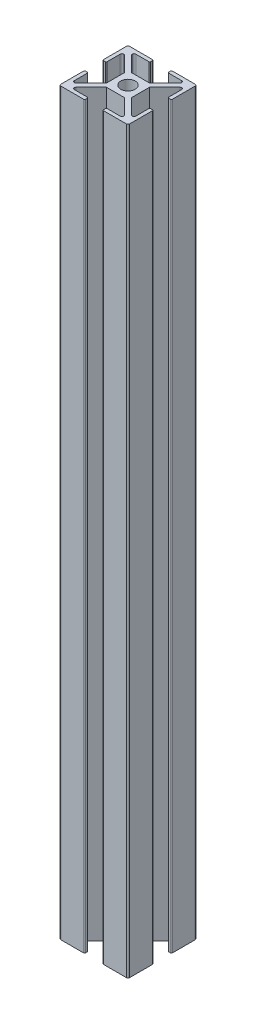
SolidWorks part; units mm, degrees
ref_plane "Front Plane" through (0, 0, 0) normal (0, 0, 1) x (1, 0, 0)
ref_plane "Top Plane" through (0, 0, 0) normal (0, 1, 0) x (1, 0, 0)
ref_plane "Right Plane" through (0, 0, 0) normal (1, 0, 0) x (0, 0, -1)
sketch "Sketch2" plane through (0, 0, 0) normal (0, 1, 0) x (1, 0, 0)
  line L12 (-10, -8.9393) -> (8.9393, 10)
  line L13 (-3.66, -3.66) -> (3.66, -3.66)
  line L26 (-3.66, -3.66) -> (-3.66, 3.66)
  line L27 (-3.66, 3.66) -> (3.66, 3.66)
  line L32 (3.66, -3.66) -> (3.66, 3.66)
  line L37 (-3.66, -3.66) -> (3.66, 3.66) construction
  line L50 (-3.66, 3.66) -> (3.66, -3.66) construction
  line L51 (-10, -8.9393) -> (-8.9393, -10)
  line L52 (8.9393, 10) -> (10, 8.9393)
  line L53 (-8.9393, -10) -> (10, 8.9393)
  line L54 (-10, -8.9393) -> (10, 8.9393) construction
  line L55 (8.9393, 10) -> (-8.9393, -10) construction
  line L56 (0, 0) -> (0, 25.4805) construction
  line L57 (10, 8.9393) -> (2.63, 8.9393)
  line L58 (-10, -8.9393) -> (-10, -10)
  line L59 (-10, -10) -> (-8.9393, -10)
  line L60 (10, 8.9393) -> (10, 10)
  line L61 (10, 10) -> (2.63, 10)
  line L62 (2.63, 8.9393) -> (2.63, 10)
  line L63 (5.995, 7.0557) -> (5.995, 8.9393)
  line L64 (10, 10) -> (10, 2.63)
  line L65 (8.9393, 10) -> (10, 10)
  line L66 (8.9393, 2.63) -> (10, 2.63)
  line L67 (8.9393, 10) -> (8.9393, 2.63)
  circle A0 centre (0, 0) radius 2.095
  point P0 (0, 0)
  dimension "D3" = 4.19
  dimension "D1" = 7.32
  dimension "D2" = 7.32
  dimension "D4" = 20
  dimension "D5" = 1.5
  dimension "D6" = 2.63
  dimension "D8" = 5.995
  dimension "D7" = 90
extrude "Boss-Extrude1" add sketch "Sketch2" along normal blind 215 contours L53 L67 L66 L64 | L67 L57 L12 L27 L32 L53 | L67 L12 L57 | L52 L67 L57 | L60 L61 L52 | L57 L67 L53 | L62 L57 L12 L61 | A0 L53 L32 L27 L12 | A0 L53 L13 L32 | A0 L12 L27 L26 | A0 L12 L26 L13 L53
fillet "Fillet1" radius 0.5 3 edges at (7.8787, 107.5, -8.9393) (8.9393, 107.5, -7.8787) (10, 107.5, -10)
fillet "Fillet2" radius 0.25 4 edges at (2.63, 107.5, -10) (2.63, 107.5, -8.9393) (8.9393, 107.5, -2.63) (10, 107.5, -2.63)
pattern_circular "CirPattern1" count 4 over 360 about axis through (0, 0, 0) along (0, 1, 0) of "Boss-Extrude1", "Fillet2", "Fillet1"
sketch "Sketch3" plane through (-10, 0, 0) normal (-1, 0, 0) x (0, 0, 1)
  line L0 (2.5993, 0) -> (-2.5993, 0) construction
  line L1 (10, 215) -> (10, 0) construction
  line L4 (-9.5, 215) -> (-2.88, 215) construction
  circle A0 centre (0, 25) radius 2.095
  circle A1 centre (0, 190) radius 2.095
  point P12 (0, 0)
  dimension "D1" = 4.19
  dimension "D2" = 25
  dimension "D3" = 10
  dimension "D4" = 25
  dimension "D5" = 10
  dimension "D6" = 4.19
extrude "Cut-Extrude2" cut sketch "Sketch3" against normal blind 60
thread "Thread1" pitch 0.7 start angle 0, offset 0, length 10, pitch 0.7, diameter 4.19
ref_plane "Plane1" through (-3.66, 190, -2.095) normal (0, -1, 0) x (0, 0, -1)
sketch "Thread Profile1" plane through (-3.66, 190, -2.095) normal (0, -1, 0) x (0, 0, -1)
  line L0 (0, 0) -> (0, 0.7) construction
  line L1 (0, 0) -> (0.3789, 0.2187)
  line L2 (0.3789, 0.2187) -> (0.3789, 0.3062)
  line L3 (0.3789, 0.3062) -> (0, 0.525)
  line L4 (0.3789, 0.2625) -> (0, 0.2625) construction
  line L11 (0, 0) -> (0, 0.525)
  point P2 (0, 0)
  dimension "Pitch" = 0.7
  dimension "Profile_Angle" = 60
  dimension "Profile_Land" = 0.0875
  dimension "Profile_Height" = 0.3789
